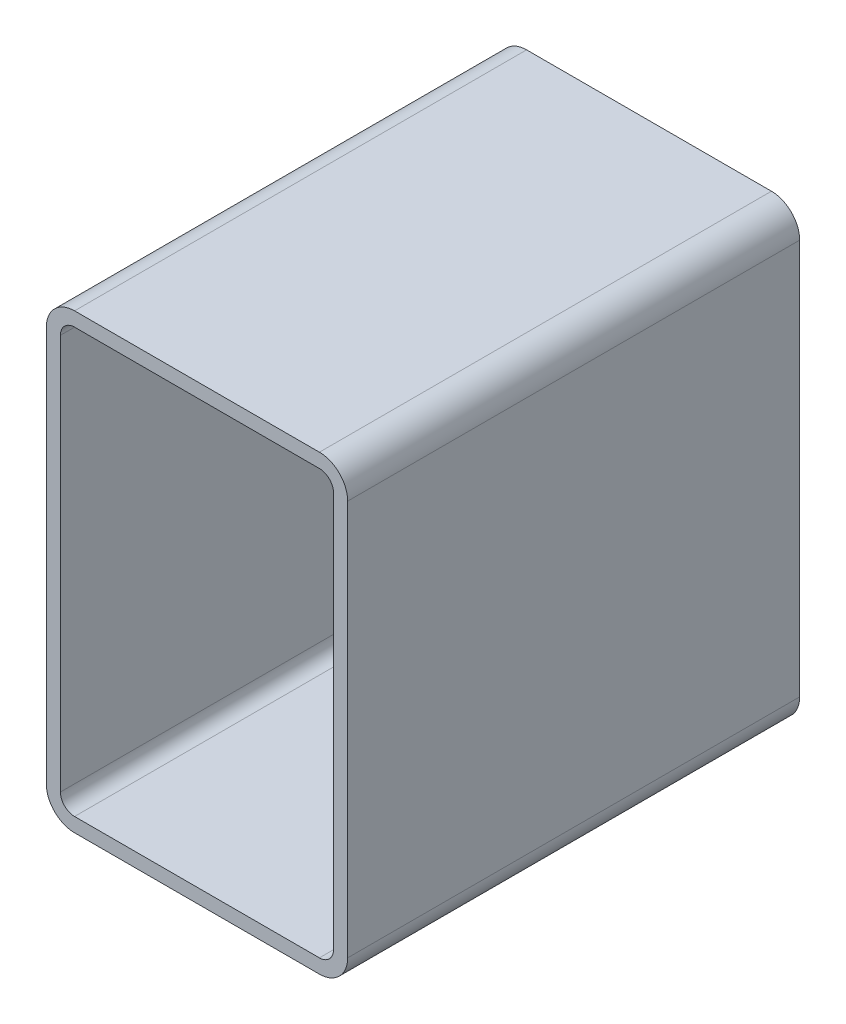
SolidWorks part; units mm, degrees
ref_plane "Front Plane" through (0, 0, 0) normal (0, 0, 1) x (1, 0, 0)
ref_plane "Top Plane" through (0, 0, 0) normal (0, 1, 0) x (1, 0, 0)
ref_plane "Right Plane" through (0, 0, 0) normal (1, 0, 0) x (0, 0, -1)
sketch "Sketch1" plane through (0, 0, 0) normal (0, 0, 1) x (1, 0, 0)
sketch_block_instance "HSS12x8x0.375-1"
sketch_block "HSS12x8x0.375"
extrude "Boss-Extrude1" add sketch "Sketch1" along normal blind 304.8
